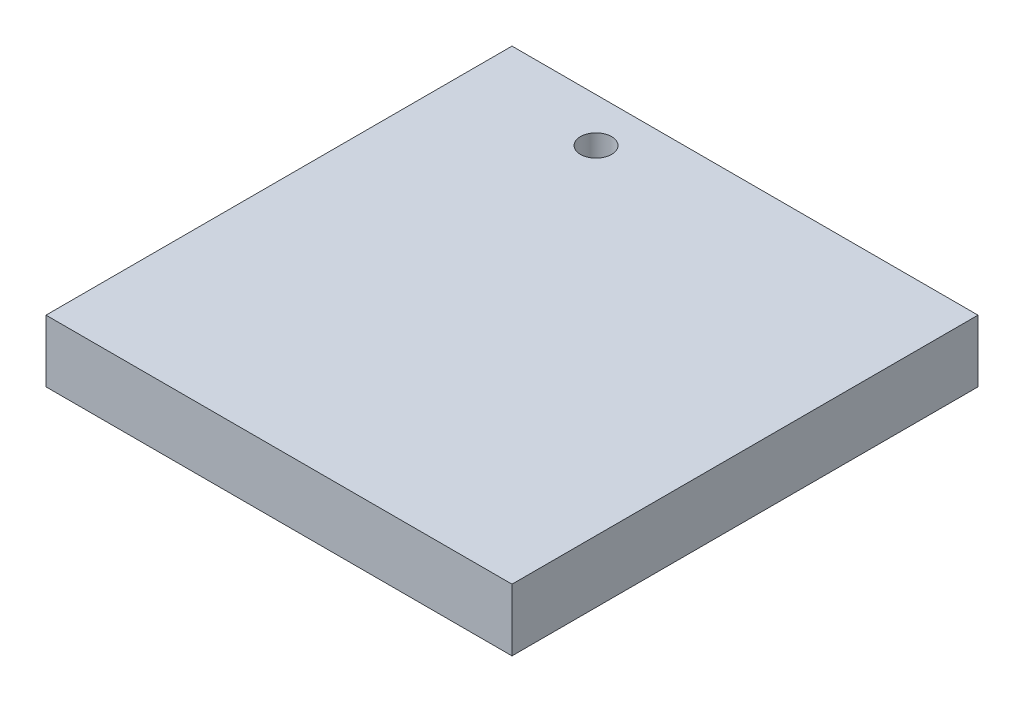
SolidWorks part; units mm, degrees
ref_plane "Front" through (0, 0, 0) normal (0, 0, 1) x (1, 0, 0)
ref_plane "Top" through (0, 0, 0) normal (0, 1, 0) x (1, 0, 0)
ref_plane "Right" through (0, 0, 0) normal (1, 0, 0) x (0, 0, -1)
sketch "Sketch1" plane through (0, 0, 0) normal (0, 1, 0) x (1, 0, 0)
  line L0 (75, -75) -> (-75, 75) construction
  line L1 (-75, 75) -> (75, 75)
  line L2 (-75, 75) -> (-75, -75)
  line L3 (-75, -75) -> (75, -75)
  line L4 (75, 75) -> (75, -75)
  dimension "D1" = 150
  dimension "D2" = 150
extrude "Extrude1" add sketch "Sketch1" along normal blind 20
sketch "Sketch2" plane through (0, 20, 0) normal (0, 1, 0) x (-1, 0, 0)
  line L0 (75, -75) -> (75, 75) construction
  line L1 (-75, -75) -> (75, -75) construction
  circle A0 centre (33.76, -60.81) radius 5
  dimension "D3" = 10
  dimension "D1" = 41.24
  dimension "D2" = 14.19
extrude "Cut-Extrude1" cut sketch "Sketch2" against normal blind 10
sketch "Sketch3" plane through (0, 20, 0) normal (0, 1, 0) x (-1, 0, 0)
  circle A1 centre (33.76, -60.81) radius 5 construction
  point P0 (33.76, -60.81)
